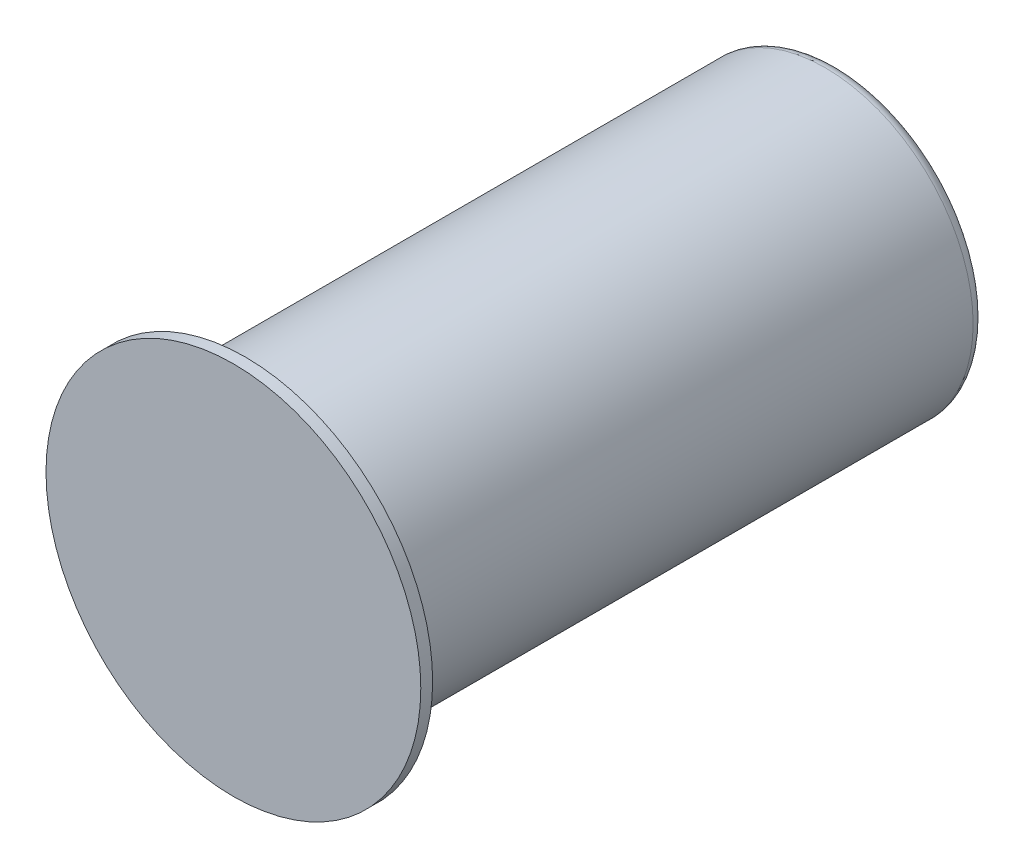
SolidWorks part; units mm, degrees
ref_plane "Front Plane" through (0, 0, 0) normal (0, 0, 1) x (1, 0, 0)
ref_plane "Top Plane" through (0, 0, 0) normal (0, 1, 0) x (1, 0, 0)
ref_plane "Right Plane" through (0, 0, 0) normal (1, 0, 0) x (0, 0, -1)
sketch "Sketch1" plane through (0, 0, 0) normal (1, 0, 0) x (0, 0, -1)
  line L0 (0, 0) -> (153, 0) construction
  line L1 (0, 0) -> (0, 47.5)
  line L2 (0, 47.5) -> (3, 47.5)
  line L3 (3, 47.5) -> (3, 37.5)
  line L4 (3, 37.5) -> (150, 37.5)
  line L5 (153, 34.5) -> (153, 6)
  line L6 (152, 5) -> (141, 5)
  line L7 (141, 5) -> (138.1132, 0)
  line L8 (152, 5) -> (153, 6)
  line L9 (0, 0) -> (138.1132, 0)
  arc A0 (150, 37.5) -> (153, 34.5) centre (150, 34.5) cw
  point P9 (153, 37.5)
  dimension "D4" = 3
  dimension "D11" = 3
  dimension "D2" = 47.5
  dimension "D3" = 37.5
  dimension "D5" = 150
  dimension "D6" = 1
  dimension "D7" = 45
  dimension "D8" = 12
  dimension "D9" = 5
  dimension "D10" = 60
revolve "Revolve1" add sketch "Sketch1" angle 360 about L0
